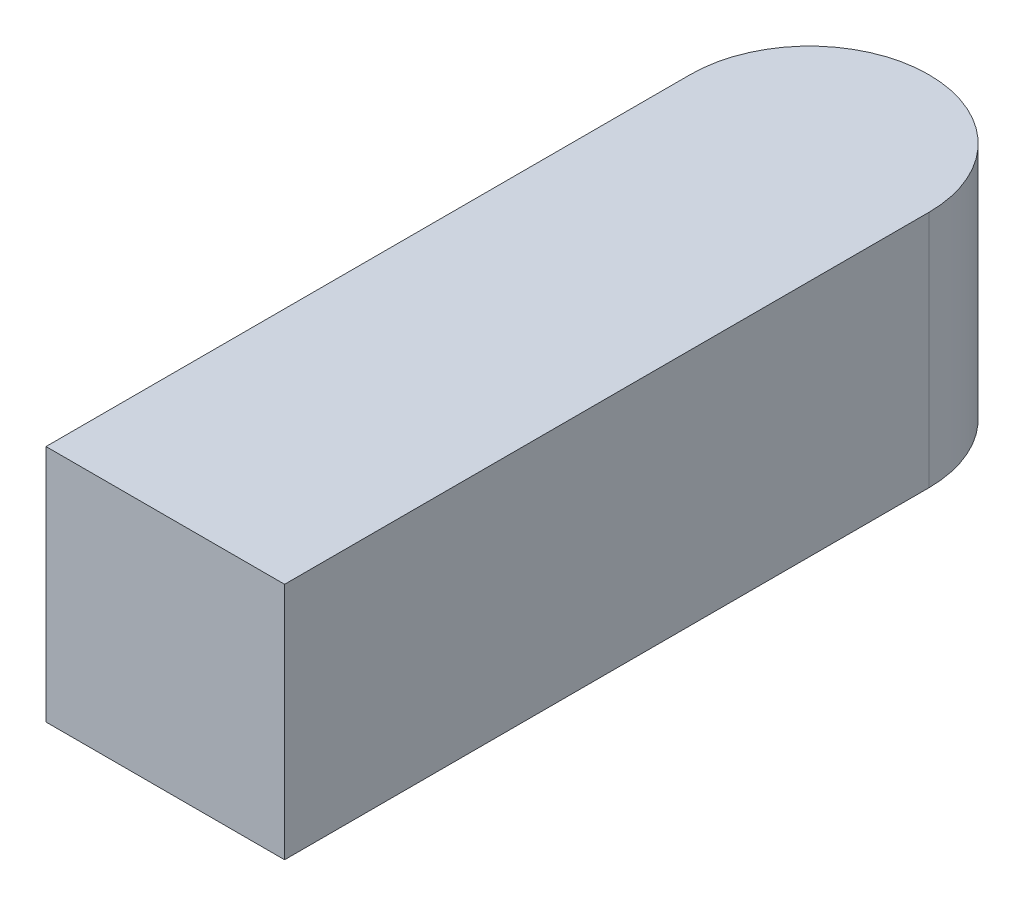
SolidWorks part; units mm, degrees
ref_plane "Face" through (0, 0, 0) normal (0, 0, 1) x (1, 0, 0)
ref_plane "Dessus" through (0, 0, 0) normal (0, 1, 0) x (1, 0, 0)
ref_plane "Droite" through (0, 0, 0) normal (1, 0, 0) x (0, 0, -1)
sketch "Esquisse1" plane through (0, 0, 0) normal (0, 0, 1) x (1, 0, 0)
  line L1 (0, 0) -> (5, 0)
  line L2 (0, 0) -> (0, 5)
  line L3 (0, 5) -> (5, 5)
  line L4 (5, 0) -> (5, 5)
  dimension "D1" = 5
  dimension "D2" = 5
extrude "Extrusion1" add sketch "Esquisse1" along normal blind 16
fillet "Congé1" radius 2.5 2 edges at (0, 2.5, 0) (5, 2.5, 0)
